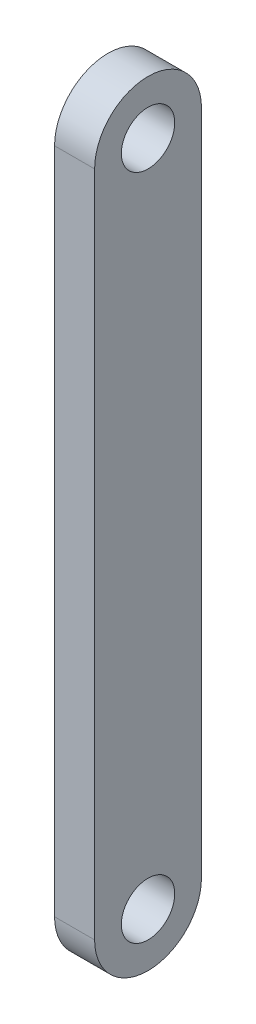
SolidWorks part; units mm, degrees
ref_plane "Front Plane" through (0, 0, 0) normal (0, 0, 1) x (1, 0, 0)
ref_plane "Top Plane" through (0, 0, 0) normal (0, 1, 0) x (1, 0, 0)
ref_plane "Right Plane" through (0, 0, 0) normal (1, 0, 0) x (0, 0, -1)
sketch "Sketch1" plane through (0, 0, 0) normal (1, 0, 0) x (0, 0, -1)
  line L0 (0, 0) -> (0, 6.5747) construction
  line L1 (4, 50) -> (4, 0)
  line L2 (-4, 50) -> (-4, 0)
  circle A0 centre (0, 0) radius 2
  circle A1 centre (0, 50) radius 2
  arc A2 (4, 50) -> (-4, 50) centre (0, 50) ccw
  arc A3 (4, 0) -> (-4, 0) centre (0, 0) cw
  dimension "D1" = 4
  dimension "D2" = 4
  dimension "D5" = 4
  dimension "D3" = 50
  dimension "D4" = 8
extrude "Boss-Extrude1" add sketch "Sketch1" along normal blind 3
